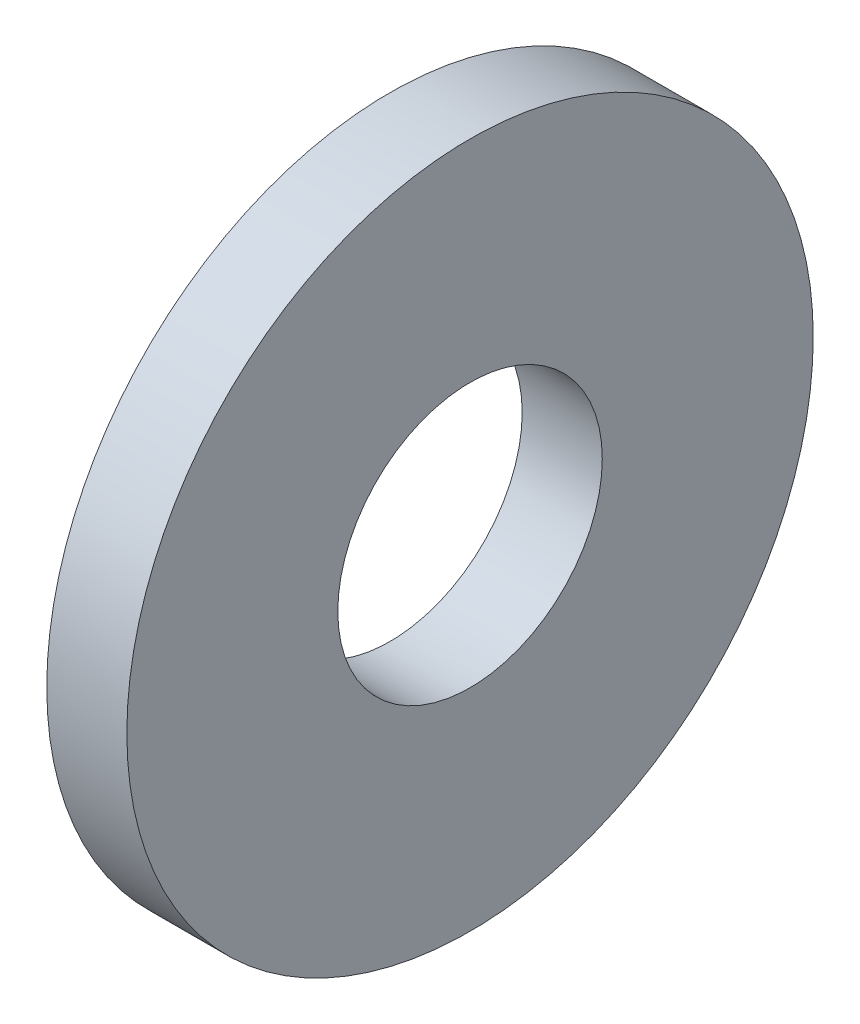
SolidWorks part; units mm, degrees
ref_plane "Plane1" through (0, 0, 0) normal (0, 0, 1) x (1, 0, 0)
ref_plane "Plane2" through (0, 0, 0) normal (0, 1, 0) x (1, 0, 0)
ref_plane "Plane3" through (0, 0, 0) normal (1, 0, 0) x (0, 0, -1)
revolve "Base-Revolve" add sketch "Sketch1" angle 360 about L0
sketch "Sketch1" plane through (0, 0, 0) normal (0, 0, 1) x (1, 0, 0)
  line L0 (-34.925, 0) -> (9.525, 0) construction
  line L1 (0, 2.89) -> (0, 7.5)
  line L2 (0, 7.5) -> (-1.75, 7.5)
  line L3 (-1.75, 7.5) -> (-1.75, 2.89)
  line L4 (-1.75, 2.89) -> (0, 2.89)
  dimension "Thickness" = 1.75
  dimension "Inside_dia" = 5.78
  dimension "Outside_dia" = 15
